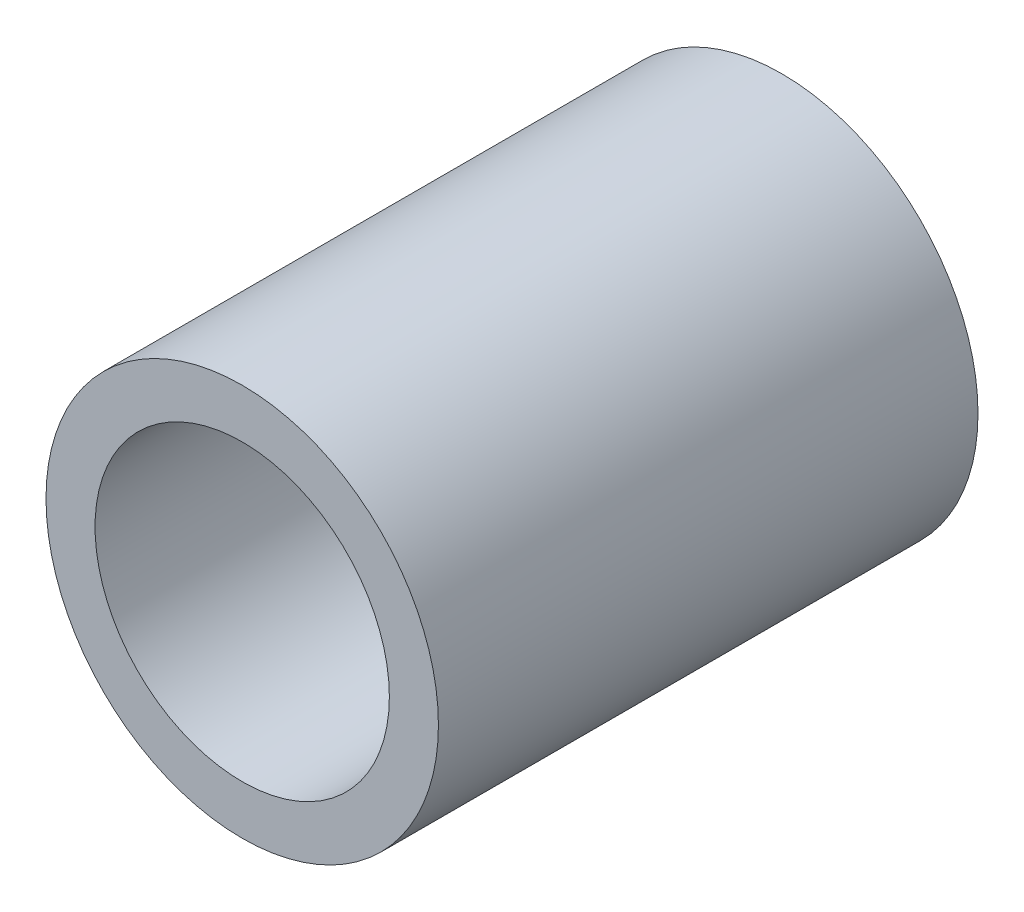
SolidWorks part; units mm, degrees
ref_plane "Plan de face" through (0, 0, 0) normal (0, 0, 1) x (1, 0, 0)
ref_plane "Plan de dessus" through (0, 0, 0) normal (0, 1, 0) x (1, 0, 0)
ref_plane "Plan de droite" through (0, 0, 0) normal (1, 0, 0) x (0, 0, -1)
sketch "Esquisse1" plane through (0, 0, 0) normal (0, 0, 1) x (1, 0, 0)
  circle A0 centre (0, 0) radius 4
  circle A1 centre (0, 0) radius 3
  dimension "D1" = 6
  dimension "D2" = 8
extrude "Extrusion1" add sketch "Esquisse1" along normal blind 11
